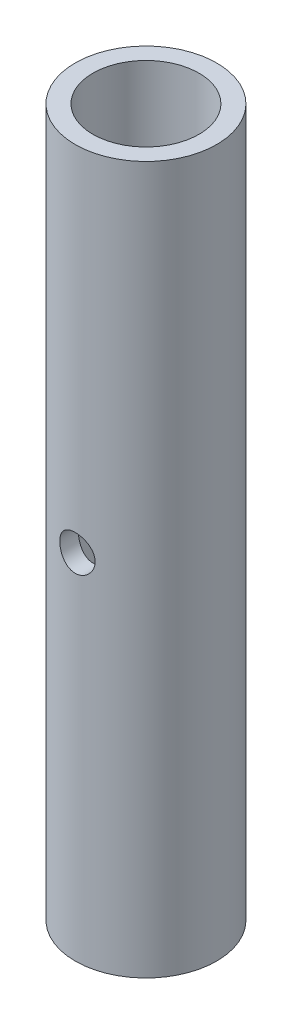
SolidWorks part; units mm, degrees
ref_plane "Front Plane" through (0, 0, 0) normal (0, 0, 1) x (1, 0, 0)
ref_plane "Top Plane" through (0, 0, 0) normal (0, 1, 0) x (1, 0, 0)
ref_plane "Right Plane" through (0, 0, 0) normal (1, 0, 0) x (0, 0, -1)
sketch "Sketch2" plane through (0, 0, 0) normal (0, 1, 0) x (1, 0, 0)
  circle A0 centre (0, 0) radius 25.4
  circle A1 centre (0, 0) radius 19.05
  dimension "D1" = 38.1
  dimension "D2" = 50.8
extrude "Boss-Extrude1" add sketch "Sketch2" along normal blind 254
sketch "Sketch3" plane through (0, 0, 0) normal (0, 0, 1) x (1, 0, 0)
  line L0 (-25.4, 254) -> (25.4, 254)
  line L1 (25.4, 254) -> (0, 254)
  line L2 (0, 254) -> (0, 127)
  circle A0 centre (0, 127) radius 6.35
  dimension "D2" = 12.7
  dimension "D1" = 127
extrude "Cut-Extrude1" cut sketch "Sketch3" against normal through all both and the other way through all contours A0
ref_plane "Plane1" through (0, 0, 25.4) normal (0, 0, 1) x (1, 0, 0)
ref_plane "Plane2" through (0, 0, 0) normal (1, 0, 0) x (0, 0, -1)
